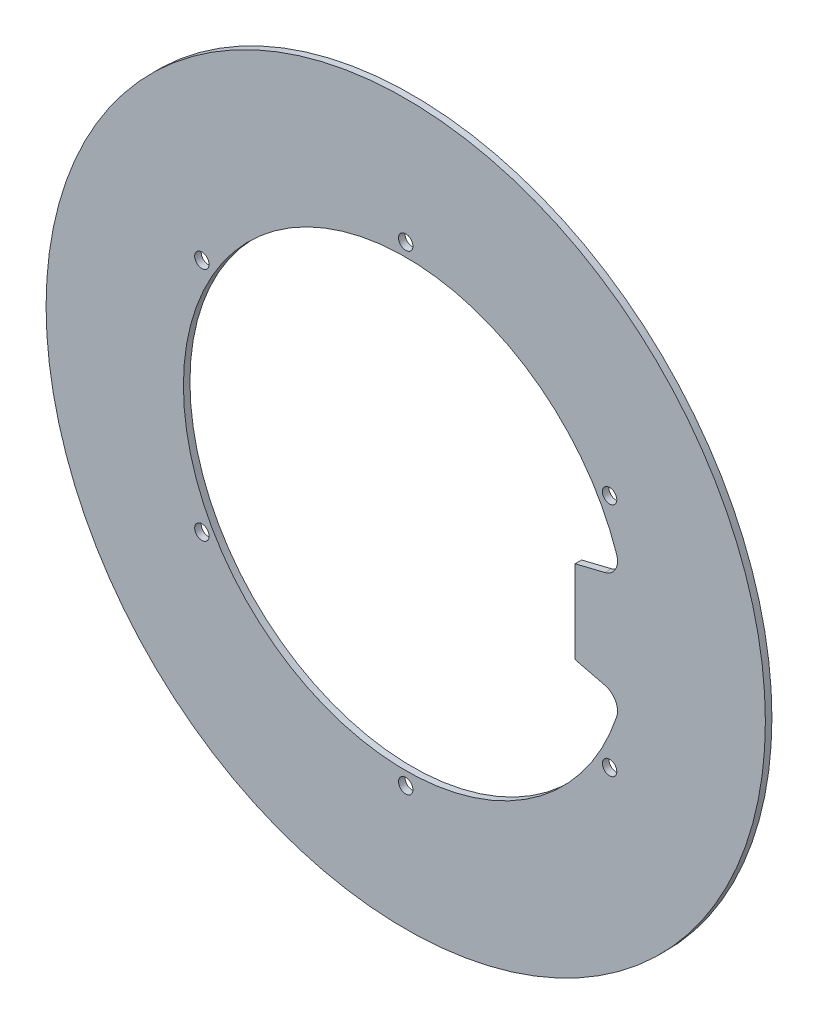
SolidWorks part; units mm, degrees
ref_plane "Front Plane" through (0, 0, 0) normal (0, 0, 1) x (1, 0, 0)
ref_plane "Top Plane" through (0, 0, 0) normal (0, 1, 0) x (1, 0, 0)
ref_plane "Right Plane" through (0, 0, 0) normal (1, 0, 0) x (0, 0, -1)
sketch "Sketch1" plane through (0, 0, 0) normal (0, 0, 1) x (1, 0, 0)
  line L0 (0, 0) -> (0, 36) construction
  line L1 (25.908, -6.35) -> (30.4558, -7.4647)
  line L2 (0, 0) -> (55, 0) construction
  line L3 (25.908, 6.35) -> (30.4558, 7.4647)
  line L4 (25.908, -6.35) -> (25.908, 6.35)
  line L5 (25.908, -6.35) -> (0, 0) construction
  line L6 (0, 0) -> (25.908, 6.35) construction
  circle A0 centre (0, 0) radius 55
  arc A1 (32.2613, 10.7335) -> (32.2613, -10.7335) centre (0, 0) ccw
  circle A2 centre (0, 36) radius 1.1
  circle A3 centre (31.1769, 18) radius 1.1
  circle A4 centre (31.1769, -18) radius 1.1
  circle A5 centre (0, -36) radius 1.1
  circle A6 centre (-31.1769, -18) radius 1.1
  circle A7 centre (-31.1769, 18) radius 1.1
  arc A8 (30.4558, 7.4647) -> (32.2613, 10.7335) centre (29.8512, 9.9316) ccw
  arc A9 (30.4558, -7.4647) -> (32.2613, -10.7335) centre (29.8512, -9.9316) cw
  point P3 (28.575, -11.5312)
  point P7 (0, 0)
  point P19 (0, 0)
  point P23 (32.9504, -8.3826)
  point P26 (33.0226, 8.0938)
  point P29 (33.0226, -8.0938)
  dimension "D1" = 110
  dimension "D2" = 68
  dimension "D3" = 2.2
  dimension "D6" = 25.908
  dimension "D8" = 2.54
  dimension "D4" = 36
  dimension "D7" = 12.7
  dimension "D5" = 6
extrude "Boss-Extrude1" add sketch "Sketch1" along normal blind 1
